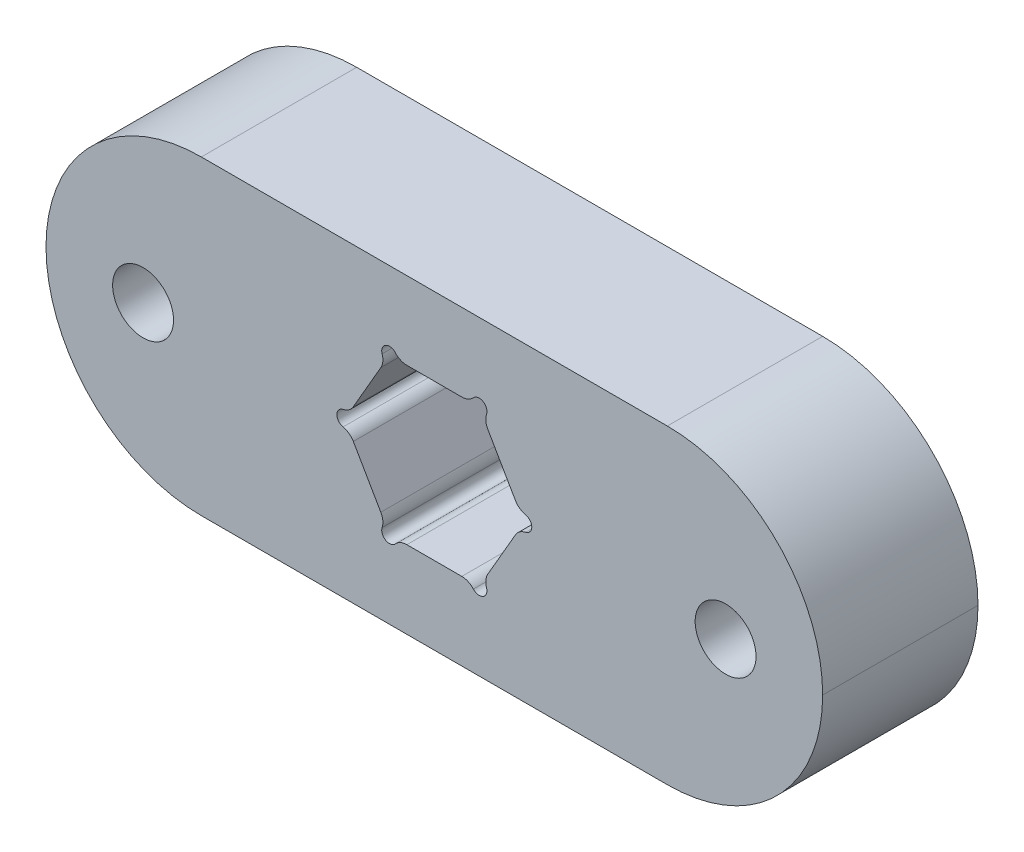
SolidWorks part; units mm, degrees
ref_plane "Front Plane" through (0, 0, 0) normal (0, 0, 1) x (1, 0, 0)
ref_plane "Top Plane" through (0, 0, 0) normal (0, 1, 0) x (1, 0, 0)
ref_plane "Right Plane" through (0, 0, 0) normal (1, 0, 0) x (0, 0, -1)
sketch "Sketch1" plane through (0, 0, 0) normal (0, 0, 1) x (1, 0, 0)
  line L0 (23.8125, 0) -> (-23.8125, 0) construction
  line L1 (7.3323, 0) -> (3.6662, 6.35)
  line L2 (3.6662, 6.35) -> (-3.6662, 6.35)
  line L3 (-3.6662, 6.35) -> (-7.3323, 0)
  line L4 (-7.3323, 0) -> (-3.6662, -6.35)
  line L5 (-3.6662, -6.35) -> (3.6662, -6.35)
  line L6 (3.6662, -6.35) -> (7.3323, 0)
  line L8 (31.75, -12.7) -> (-31.75, -12.7)
  line L9 (31.75, -12.7) -> (31.75, 12.7)
  line L10 (31.75, 12.7) -> (-31.75, 12.7)
  line L11 (-31.75, -12.7) -> (-31.75, 12.7)
  line L12 (31.75, -12.7) -> (-31.75, 12.7) construction
  line L13 (31.75, 12.7) -> (-31.75, -12.7) construction
  circle A0 centre (0, 0) radius 6.35 construction
  circle A1 centre (-23.8125, 0) radius 2.4892
  circle A2 centre (23.8125, 0) radius 2.4892
  point P12 (0, 0)
  dimension "D1" = 12.7
  dimension "D5" = 4.9784
  dimension "D2" = 47.625
  dimension "D3" = 25.4
  dimension "D4" = 63.5
extrude "Boss-Extrude1" add sketch "Sketch1" along normal blind 12.7
sketch "Sketch2" plane through (0, 0, 12.7) normal (0, 0, 1) x (1, 0, 0)
  circle A0 centre (-3.6662, 6.35) radius 0.635
  circle A1 centre (3.6662, 6.35) radius 0.635
  circle A2 centre (7.3323, 0) radius 0.635
  circle A3 centre (3.6662, -6.35) radius 0.635
  circle A4 centre (-3.6662, -6.35) radius 0.635
  circle A5 centre (-7.3323, 0) radius 0.635
  dimension "D1" = 1.27
extrude "Cut-Extrude1" cut sketch "Sketch2" against normal through all
fillet "Fillet1" radius 1.27 12 edges at (-7.0148, -0.5499, 6.35) (-3.9837, -5.8001, 6.35) (-3.0312, -6.35, 6.35) (3.0312, -6.35, 6.35) (3.9837, -5.8001, 6.35) (7.0148, -0.5499, 6.35) (7.0148, 0.5499, 6.35) (3.9837, 5.8001, 6.35) (3.0312, 6.35, 6.35) (-7.0148, 0.5499, 6.35) (-3.9837, 5.8001, 6.35) (-3.0312, 6.35, 6.35)
fillet "Fillet2" radius 12.7 4 edges at (-31.75, 12.7, 6.35) (-31.75, -12.7, 6.35) (31.75, -12.7, 6.35) (31.75, 12.7, 6.35)
